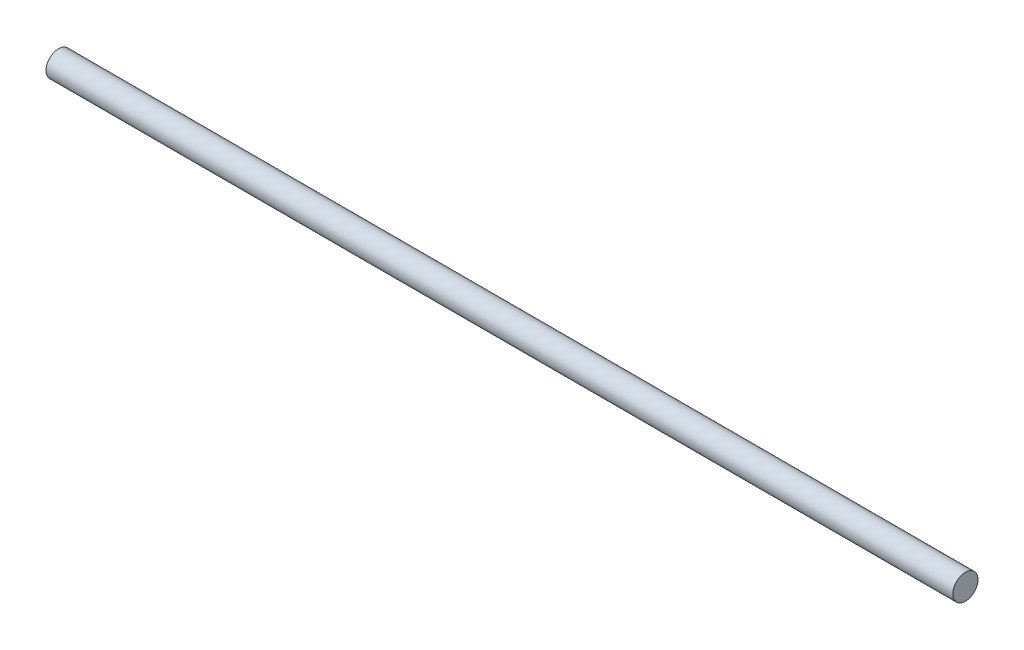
SolidWorks part; units mm, degrees
ref_plane "Front Plane" through (0, 0, 0) normal (0, 0, 1) x (1, 0, 0)
ref_plane "Top Plane" through (0, 0, 0) normal (0, 1, 0) x (1, 0, 0)
ref_plane "Right Plane" through (0, 0, 0) normal (1, 0, 0) x (0, 0, -1)
sketch "Sketch1" plane through (0, 0, 0) normal (1, 0, 0) x (0, 0, -1)
  circle A0 centre (0, 0) radius 3.175
  dimension "D1" = 6.35
extrude "Boss-Extrude1" add sketch "Sketch1" along normal mid plane 228.6
